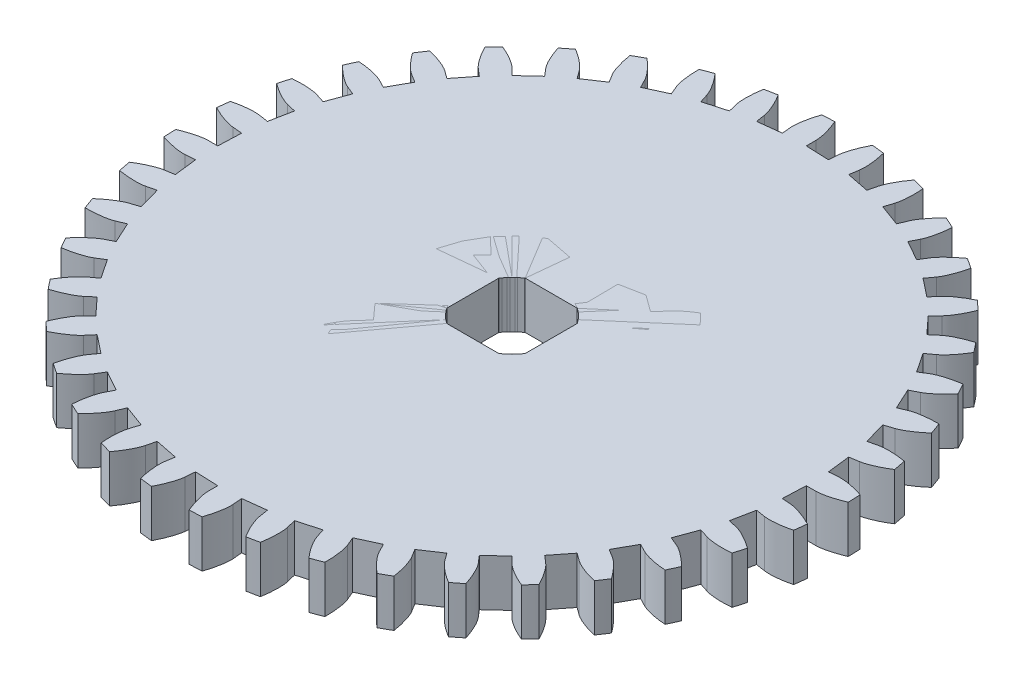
SolidWorks part; units mm, degrees
ref_plane "Front Plane" through (0, 0, 0) normal (0, 0, 1) x (1, 0, 0)
ref_plane "Top Plane" through (0, 0, 0) normal (0, 1, 0) x (1, 0, 0)
ref_plane "Right Plane" through (0, 0, 0) normal (1, 0, 0) x (0, 0, -1)
sketch "Sketch1" plane through (0, 0, 0) normal (0, 1, 0) x (1, 0, 0)
  line L0 (0, 0) -> (0, 9.6815) construction
  line L1 (0, 0) -> (-9.6815, 0) construction
  line L2 (0, 0) -> (-10.4919, -0.4122) construction
  line L3 (0, 0) -> (-9.6516, -0.7596) construction
  line L4 (0, 0) -> (-9.5623, -1.5145) construction
  circle A0 centre (0, 0) radius 10 construction
  circle A1 centre (0, 0) radius 9.6815 construction
  circle A2 centre (0, 0) radius 9.375 construction
  circle A3 centre (0, 0) radius 10.5 construction
  spline S0 degree 4 poles (-9.6815, 0) (-9.6978, 0) (-9.7436, -0.0017) (-9.8299, -0.0115) (-9.9693, -0.0368) (-10.1443, -0.0827) (-10.3662, -0.1574) (-10.6212, -0.2646) (-10.8931, -0.4023) (-11.1787, -0.5725) (-11.4536, -0.7601) (-11.7175, -0.9628) (-11.9704, -1.1789) (-12.2643, -1.4557) (-12.5986, -1.8099) (-12.9609, -2.2506) (-13.3365, -2.7854) (-13.6788, -3.3564) (-13.9817, -3.949) (-14.2463, -4.56) (-14.4449, -5.1071) (-14.5924, -5.5844) (-14.722, -6.0652) (-14.8153, -6.4724) (-14.894, -6.8773) (-14.9588, -7.293) (-15.0019, -7.6142) (-15.0376, -7.9608) (-15.0636, -8.264) (-15.0877, -8.7119) (-15.0947, -8.9809) (-15.0984, -9.4109) (-15.0902, -9.6182) (-15.0869, -9.7968) (-15.0834, -9.845) (-15.0821, -9.8846) knots 0 0 0 0 0 0.005377 0.015084 0.028532 0.04661 0.064855 0.092111 0.119476 0.146842 0.174209 0.201575 0.228941 0.256307 0.307035 0.361767 0.4165 0.471232 0.525964 0.580697 0.635429 0.662795 0.690161 0.744894 0.77226 0.799626 0.826992 0.854358 0.881725 0.909091 0.954545 0.977273 0.988636 1 1 1 1 1 construction
  spline S1 degree 4 poles (-9.6815, 0) (-9.6978, 0) (-9.7436, -0.0017) (-9.8299, -0.0115) (-9.9693, -0.0368) (-10.1443, -0.0827) (-10.3662, -0.1574) (-10.6212, -0.2646) (-10.8931, -0.4023) (-11.1787, -0.5725) (-11.4536, -0.7601) (-11.7175, -0.9628) (-11.9704, -1.1789) (-12.2643, -1.4557) (-12.5986, -1.8099) (-12.9609, -2.2506) (-13.3365, -2.7854) (-13.6788, -3.3564) (-13.9817, -3.949) (-14.2463, -4.56) (-14.4449, -5.1071) (-14.5924, -5.5844) (-14.722, -6.0652) (-14.8153, -6.4724) (-14.894, -6.8773) (-14.9588, -7.293) (-15.0019, -7.6142) (-15.0376, -7.9608) (-15.0636, -8.264) (-15.0791, -8.5523) (-15.0855, -8.7049) (-15.088, -8.7805) knots 0 0 0 0 0 0.005377 0.015084 0.028532 0.04661 0.064855 0.092111 0.119476 0.146842 0.174209 0.201575 0.228941 0.256307 0.307035 0.361767 0.4165 0.471232 0.525964 0.580697 0.635429 0.662795 0.690161 0.744894 0.77226 0.799626 0.826992 0.854358 0.881725 0.909091 0.909091 0.909091 0.909091 0.909091
  dimension "D1" = 21
  dimension "D2" = 20
  dimension "D3" = 19.363
  dimension "D4" = 18.75
  dimension "D5" = 9.6815
  dimension "D6" = 2.25
  dimension "D7" = 4.5
  dimension "D8" = 9
sketch "Sketch2" plane through (0, 0, 0) normal (0, 1, 0) x (1, 0, 0)
  line L0 (0, 0) -> (-10.4919, -0.4122) construction
  line L1 (0, 0) -> (-10.4919, -0.4122) construction
  line L2 (0, 0) -> (-9.6516, -0.7596) construction
  line L3 (0, 0) -> (-9.6815, 0) construction
  line L4 (0, 0) -> (-9.5623, -1.5145) construction
  line L5 (0, 0) -> (-9.6516, -0.7596) construction
  line L6 (0, 0) -> (-9.6815, 0) construction
  line L7 (0, 0) -> (-9.5623, -1.5145) construction
  line L8 (-9.6516, -0.7596) -> (-9.3461, -0.7356)
  line L9 (-9.3461, -0.7356) -> (-9.2596, -1.4666)
  line L10 (-9.2596, -1.4666) -> (-9.5623, -1.5145) construction
  line L11 (-9.2596, -1.4666) -> (-1.4815, -0.2347)
  line L12 (-9.6815, 0) -> (-1.5, 0)
  circle A0 centre (0, 0) radius 9.375 construction
  circle A1 centre (0, 0) radius 9.6815 construction
  circle A2 centre (0, 0) radius 10 construction
  circle A3 centre (0, 0) radius 10.5 construction
  circle A4 centre (0, 0) radius 9.375 construction
  circle A5 centre (0, 0) radius 9.6815 construction
  circle A6 centre (0, 0) radius 10 construction
  circle A7 centre (0, 0) radius 10.5 construction
  arc A8 (-10.4823, -0.6097) -> (-10.4978, -0.2146) centre (0, 0) cw
  circle A11 centre (0, 0) radius 1.5 construction
  arc A12 (-1.5, 0) -> (-1.4815, -0.2347) centre (0, 0) ccw
  spline S0 degree 4 poles (-38.6747, -999.5783) (-7.1104, -22.9083) (-7.6896, -0.5022) (-8.8715, 0.1628) (-9.9693, -0.0368) (-10.1443, -0.0827) (-10.3662, -0.1574) (-10.6212, -0.2646) (-10.8931, -0.4023) (-11.1787, -0.5725) (-11.4536, -0.7601) (-11.7175, -0.9628) (-11.9704, -1.1789) (-12.2643, -1.4557) (-12.5986, -1.8099) (-12.9609, -2.2506) (-13.3365, -2.7854) (-13.6788, -3.3564) (-13.9817, -3.949) (-14.2463, -4.56) (-14.4449, -5.1071) (-14.5924, -5.5844) (-14.722, -6.0652) (-14.8153, -6.4724) (-14.894, -6.8773) (-14.9588, -7.293) (-15.0019, -7.6142) (-15.0376, -7.9608) (-15.161, -9.398) (-15.1342, -12.9421) (-13.6536, 22.3985) (-47.5133, -1008.2245) knots -0.320432 -0.320432 -0.320432 -0.320432 -0.320432 0.005377 0.015084 0.028532 0.04661 0.064855 0.092111 0.119476 0.146842 0.174209 0.201575 0.228941 0.256307 0.307035 0.361767 0.4165 0.471232 0.525964 0.580697 0.635429 0.662795 0.690161 0.744894 0.77226 0.799626 0.826992 0.854358 0.881725 1.318475 1.318475 1.318475 1.318475 1.318475 only from (-9.6815, 0) to (-15.088, -8.7805) construction
  spline S1 degree 4 poles (-9.6815, 0) (-9.6978, 0) (-9.7436, -0.0017) (-9.8299, -0.0115) (-9.9693, -0.0368) (-10.1443, -0.0827) (-10.302, -0.1358) (-10.4189, -0.1814) (-10.4839, -0.2087) (-10.4978, -0.2146) knots 0 0 0 0 0 0.005377 0.015084 0.028532 0.04661 0.064855 0.06982 0.06982 0.06982 0.06982 0.06982
  spline S2 degree 4 poles (-9.6516, -0.7596) (-9.6679, -0.7609) (-9.7137, -0.7628) (-9.8005, -0.7598) (-9.9414, -0.7455) (-10.1195, -0.7134) (-10.2809, -0.6729) (-10.401, -0.6366) (-10.468, -0.6145) (-10.4823, -0.6097) knots 0 0 0 0 0 0.005377 0.015084 0.028532 0.04661 0.064855 0.06982 0.06982 0.06982 0.06982 0.06982
  point P21 (-9.3461, -0.7356)
  point P24 (-9.2596, -1.4666)
  dimension "D2" = 3
extrude "Boss-Extrude1" add sketch "Sketch2" along normal blind 1.5
pattern_circular "CirPattern1" count 40 over 360 of "Boss-Extrude1"
sketch "Sketch3" plane through (0, 1.5, 0) normal (0, 1, 0) x (1, 0, 0)
  line L1 (-0.8292, -1.25) -> (0.8292, -1.25)
  line L2 (-1.25, -0.8292) -> (-1.25, 0.8292)
  line L3 (-0.8292, 1.25) -> (0.8292, 1.25)
  line L4 (1.25, -0.8292) -> (1.25, 0.8292)
  arc A0 (-1.25, 0.8292) -> (-1.25, -0.8292) centre (0, 0) ccw
  circle A1 centre (0, 0) radius 1.5 construction
  arc A2 (0.8292, 1.25) -> (-0.8292, 1.25) centre (0, 0) ccw
  arc A3 (1.25, -0.8292) -> (1.25, 0.8292) centre (0, 0) ccw
  arc A4 (-0.8292, -1.25) -> (0.8292, -1.25) centre (0, 0) ccw
  dimension "D1" = 2.5
extrude "Boss-Extrude2" add sketch "Sketch3" against normal up to surface (1.5 mm away)
equation "\"Module\"= .5"
equation "\"Number of Teeth\"= 40"
equation "\"Pressure Angle\"= 14.5deg"
equation "\"Pitch Diameter\"= \"Number of Teeth\" * \"Module\""
equation "\"Circular Pitch\"= pi * \"Module\""
equation "\"Addendum\"= \"Module\""
equation "\"Dedendum\"= 1.25 * \"Module\""
equation "\"Base Diameter\"= \"Pitch Diameter\" * cos ( \"Pressure Angle\" )"
equation "\"Base Radius\"= \"Base Diameter\" / 2"
equation "\"Width\"= 1.5"
equation "\"Outside Diameter\"= \"Pitch Diameter\" + 2 * \"Addendum\""
equation "\"D1@Sketch1\"=\"Outside Diameter\""
equation "\"D3@Sketch1\"=\"Base Diameter\""
equation "\"Root Diameter\"= \"Pitch Diameter\" - 2 * \"Dedendum\""
equation "\"D4@Sketch1\"=\"Root Diameter\""
equation "\"Tooth Angle\"= 360 / \"Number of Teeth\""
equation "\"D6@Sketch1\"=\"Tooth Angle\"/4"
equation "\"D7@Sketch1\"=\"Tooth Angle\"/2"
equation "\"D8@Sketch1\"=\"Tooth Angle\""
equation "\"D2@Sketch1\" = \"Pitch Diameter\""
equation "\"Shaft Diameter\"= 3"
equation "\"D1@CirPattern1\" = \"Number of Teeth\""
equation "\"D2@Sketch2\"= \"Shaft Diameter\""
equation "\"D1@Boss-Extrude1\" = \"Width\""
